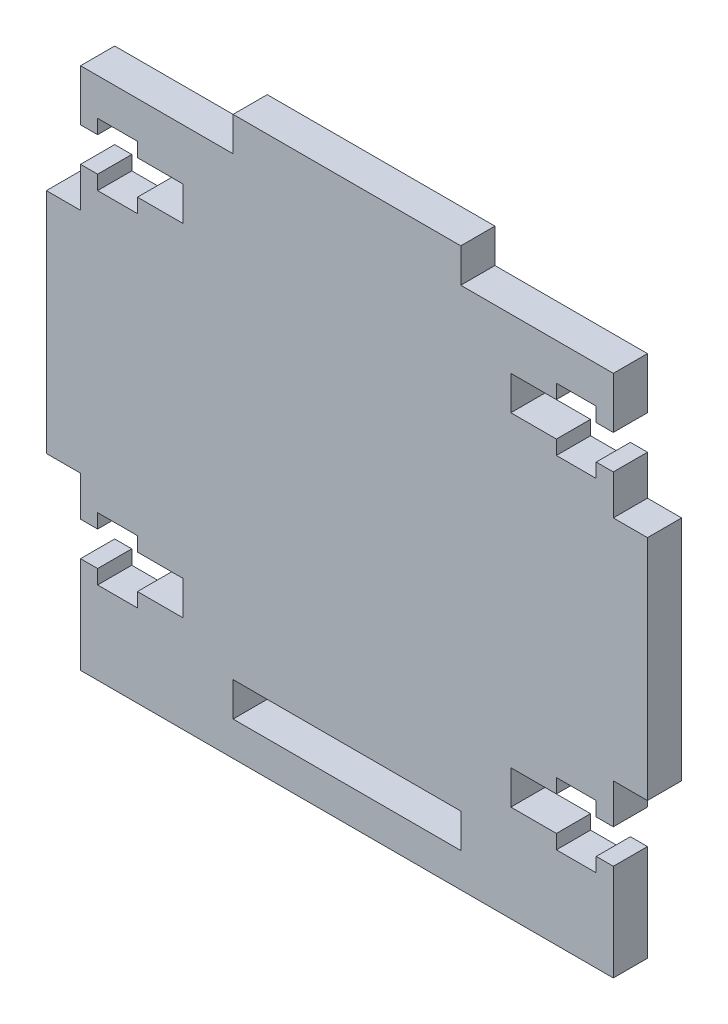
SolidWorks part; units mm, degrees
ref_plane "Front Plane" through (0, 0, 0) normal (0, 0, 1) x (1, 0, 0)
ref_plane "Top Plane" through (0, 0, 0) normal (0, 1, 0) x (1, 0, 0)
ref_plane "Right Plane" through (0, 0, 0) normal (1, 0, 0) x (0, 0, -1)
sketch "Sketch1" plane through (0, 0, 0) normal (0, 0, 1) x (1, 0, 0)
  line L0 (26.4, -9.5) -> (26.4, 10.5)
  line L1 (26.4, 10.5) -> (23.4, 10.5)
  line L2 (23.4, 10.5) -> (23.4, -9.5)
  line L3 (23.4, -9.5) -> (26.4, -9.5)
  line L4 (-23.4, -9.5) -> (-23.4, 10.5)
  line L5 (-23.4, 10.5) -> (-26.4, 10.5)
  line L6 (-26.4, 10.5) -> (-26.4, -9.5)
  line L7 (-26.4, -9.5) -> (-23.4, -9.5)
  line L8 (10, 24.5) -> (-10, 24.5)
  line L9 (-10, 24.5) -> (-10, 21.5)
  line L10 (-10, 21.5) -> (10, 21.5)
  line L11 (10, 21.5) -> (10, 24.5)
  line L12 (-1026.4, 15.5) -> (48973.6, 15.5) construction
  line L13 (-23.4, 21.5) -> (23.4, 21.5)
  line L14 (-23.4, 21.5) -> (-23.4, -24.5)
  line L15 (-23.4, -24.5) -> (23.4, -24.5)
  line L16 (23.4, 21.5) -> (23.4, -24.5)
  line L17 (-1026.4, -14.5) -> (48973.6, -14.5) construction
  line L18 (0, -975.5) -> (0, 49024.5) construction
  line L19 (-14.4, 14) -> (-23.4, 14)
  line L20 (-14.4, 14) -> (-14.4, 17)
  line L21 (-14.4, 17) -> (-23.4, 17)
  line L22 (-23.4, 14) -> (-23.4, 17)
  line L23 (-14.4, 14) -> (-23.4, 17) construction
  line L24 (-14.4, 17) -> (-23.4, 14) construction
  line L25 (-23.4, -16) -> (-14.4, -16)
  line L26 (-23.4, -16) -> (-23.4, -13)
  line L27 (-23.4, -13) -> (-14.4, -13)
  line L28 (-14.4, -16) -> (-14.4, -13)
  line L29 (-23.4, -16) -> (-14.4, -13) construction
  line L30 (-23.4, -13) -> (-14.4, -16) construction
  line L31 (21.9, -11.75) -> (18.4, -17.25) construction
  line L32 (-21.9, 12.75) -> (-18.4, 12.75)
  line L33 (-21.9, 12.75) -> (-21.9, 18.25)
  line L34 (-21.9, 18.25) -> (-18.4, 18.25)
  line L35 (-18.4, 12.75) -> (-18.4, 18.25)
  line L36 (-21.9, 12.75) -> (-18.4, 18.25) construction
  line L37 (-21.9, 18.25) -> (-18.4, 12.75) construction
  line L38 (-21.9, -17.25) -> (-18.4, -17.25)
  line L39 (-21.9, -17.25) -> (-21.9, -11.75)
  line L40 (-21.9, -11.75) -> (-18.4, -11.75)
  line L41 (-18.4, -17.25) -> (-18.4, -11.75)
  line L42 (-21.9, -17.25) -> (-18.4, -11.75) construction
  line L43 (-21.9, -11.75) -> (-18.4, -17.25) construction
  line L44 (21.9, -17.25) -> (18.4, -11.75) construction
  line L45 (23.4, -13) -> (14.4, -16) construction
  line L46 (23.4, -16) -> (14.4, -13) construction
  line L47 (18.4, -17.25) -> (18.4, -11.75)
  line L48 (21.9, -11.75) -> (18.4, -11.75)
  line L49 (21.9, -17.25) -> (21.9, -11.75)
  line L50 (21.9, -17.25) -> (18.4, -17.25)
  line L51 (14.4, -16) -> (14.4, -13)
  line L52 (23.4, -13) -> (14.4, -13)
  line L53 (23.4, -16) -> (23.4, -13)
  line L54 (23.4, -16) -> (14.4, -16)
  line L55 (21.9, 18.25) -> (18.4, 12.75) construction
  line L56 (21.9, 12.75) -> (18.4, 18.25) construction
  line L57 (14.4, 17) -> (23.4, 14) construction
  line L58 (14.4, 14) -> (23.4, 17) construction
  line L59 (18.4, 12.75) -> (18.4, 18.25)
  line L60 (21.9, 18.25) -> (18.4, 18.25)
  line L61 (21.9, 12.75) -> (21.9, 18.25)
  line L62 (21.9, 12.75) -> (18.4, 12.75)
  line L63 (23.4, 14) -> (23.4, 17)
  line L64 (14.4, 17) -> (23.4, 17)
  line L65 (14.4, 14) -> (14.4, 17)
  line L66 (14.4, 14) -> (23.4, 14)
  point P19 (-18.9, 15.5)
  point P25 (-18.9, -14.5)
  point P30 (-20.15, 15.5)
  point P34 (0, 24.5)
  point P38 (-20.15, -14.5)
  point P51 (20.15, -14.5)
  point P52 (18.9, -14.5)
  point P61 (20.15, 15.5)
  point P62 (18.9, 15.5)
  dimension "D1" = 3
  dimension "D2" = 9
  dimension "D3" = 3
  dimension "D4" = 9
  dimension "D5" = 3.5
  dimension "D6" = 5.5
  dimension "D7" = 1.5
  dimension "D8" = 3.5
  dimension "D9" = 5.5
extrude "Boss-Extrude1" add sketch "Sketch1" along normal blind 3 contours L66 L65 L64 L59 L60 L61 L16 L13 L10 L14 L21 L33 L34 L35 L20 L19 L32 L4 L27 L39 L40 L41 L28 L25 L38 L15 L54 L49 L50 L47 L51 L52 L48 | L10 L11 L8 L9 | L2 L3 L0 L1 | L6 L7 L4 L5
sketch "Sketch2" plane through (0, 0, 3) normal (0, 0, 1) x (1, 0, 0)
  line L0 (-23.4, -24.5) -> (23.4, -24.5) construction
  line L1 (-10, -18.5) -> (10, -18.5)
  line L2 (-10, -18.5) -> (-10, -21.5)
  line L3 (-10, -21.5) -> (10, -21.5)
  line L4 (10, -18.5) -> (10, -21.5)
  point P4 (0, -18.5)
  dimension "D1" = 3
  dimension "D2" = 3
  dimension "D3" = 20
extrude "Cut-Extrude1" cut sketch "Sketch2" against normal blind 10
